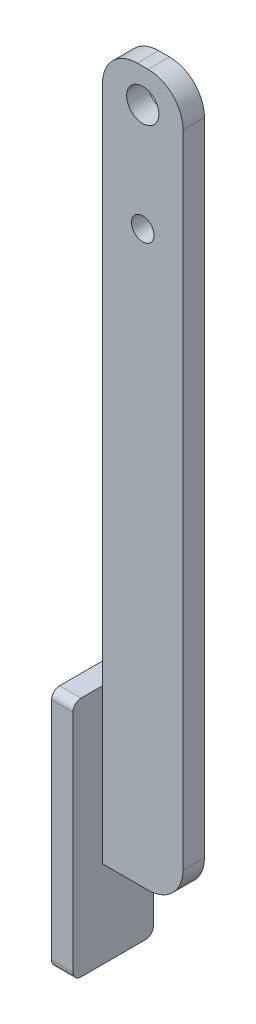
SolidWorks part; units mm, degrees
ref_plane "Front Plane" through (0, 0, 0) normal (0, 0, 1) x (1, 0, 0)
ref_plane "Top Plane" through (0, 0, 0) normal (0, 1, 0) x (1, 0, 0)
ref_plane "Right Plane" through (0, 0, 0) normal (1, 0, 0) x (0, 0, -1)
sketch "Sketch1" plane through (0, 0, 0) normal (0, 0, 1) x (1, 0, 0)
  line L1 (-15, 12.5) -> (15, 12.5)
  line L2 (-15, 12.5) -> (-15, -252.5)
  line L3 (-15, -252.5) -> (15, -252.5)
  line L4 (15, 12.5) -> (15, -252.5)
  circle A0 centre (0, 0) radius 6
  circle A1 centre (0, -40) radius 4.2
  point P3 (0, -40)
  point P4 (0, 0)
  point P5 (0, -240)
  dimension "D1" = 12
  dimension "D8" = 8.4
  dimension "D2" = 40
  dimension "D3" = 240
  dimension "D4" = 12.5
  dimension "D5" = 15
  dimension "D6" = 15
  dimension "D7" = 12.5
extrude "Boss-Extrude1" add sketch "Sketch1" along normal mid plane 8 contours A1 | A0 | L2 L1 L4 L3
fillet "Fillet1" radius 13 2 edges at (15, 12.5, 0) (-15, 12.5, 0)
sketch "Sketch2" plane through (-15, 0, 0) normal (-1, 0, 0) x (0, 0, 1)
  line L1 (-15, -195) -> (15, -195)
  line L2 (-15, -195) -> (-15, -285)
  line L3 (-15, -285) -> (15, -285)
  line L4 (15, -195) -> (15, -285)
  line L5 (-15, -195) -> (15, -285) construction
  line L6 (-15, -285) -> (15, -195) construction
  point P0 (0, -240)
  point P1 (0, -240)
  dimension "D1" = 240
  dimension "D2" = 90
  dimension "D3" = 30
extrude "Boss-Extrude2" add sketch "Sketch2" along normal blind 8 contours L4 L3 L2 L1
sketch "Sketch3" plane through (-23, 0, 0) normal (-1, 0, 0) x (0, 0, 1)
  line L0 (-15, -195) -> (15, -195) construction
  circle A0 centre (0, -240) radius 5.7361
  dimension "D1" = 45
extrude "Cut-Extrude1" cut sketch "Sketch3" against normal blind 1 contours A0
fillet "Fillet2" radius 3 4 edges at (-19, -285, -15) (-19, -285, 15) (-19, -195, -15) (-19, -195, 15)
fillet "Fillet3" radius 13 1 edges at (15, -252.5, 0)
